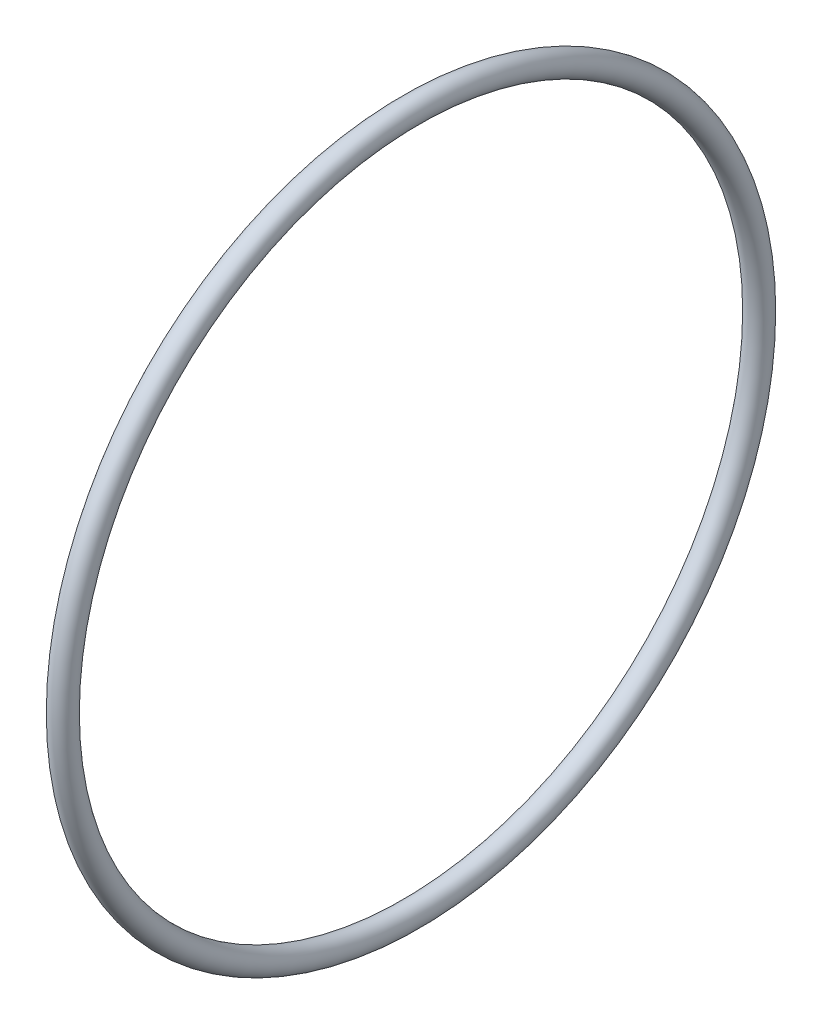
SolidWorks part; units mm, degrees
ref_plane "Front" through (0, 0, 0) normal (0, 0, 1) x (1, 0, 0)
ref_plane "Top" through (0, 0, 0) normal (0, 1, 0) x (1, 0, 0)
ref_plane "Right" through (0, 0, 0) normal (1, 0, 0) x (0, 0, -1)
sketch "Sketch1" plane through (0, 0, 0) normal (0, 0, 1) x (1, 0, 0)
  line L0 (0, 0) -> (-7.4041, 0) construction
  line L1 (0, 52.5653) -> (-1.7653, 52.5653) construction
  circle A0 centre (0, 52.5653) radius 1.7653
  dimension "D1" = 3.5306
  dimension "D2" = 50.8
revolve "Revolve1" add sketch "Sketch1" angle 360 about L0
